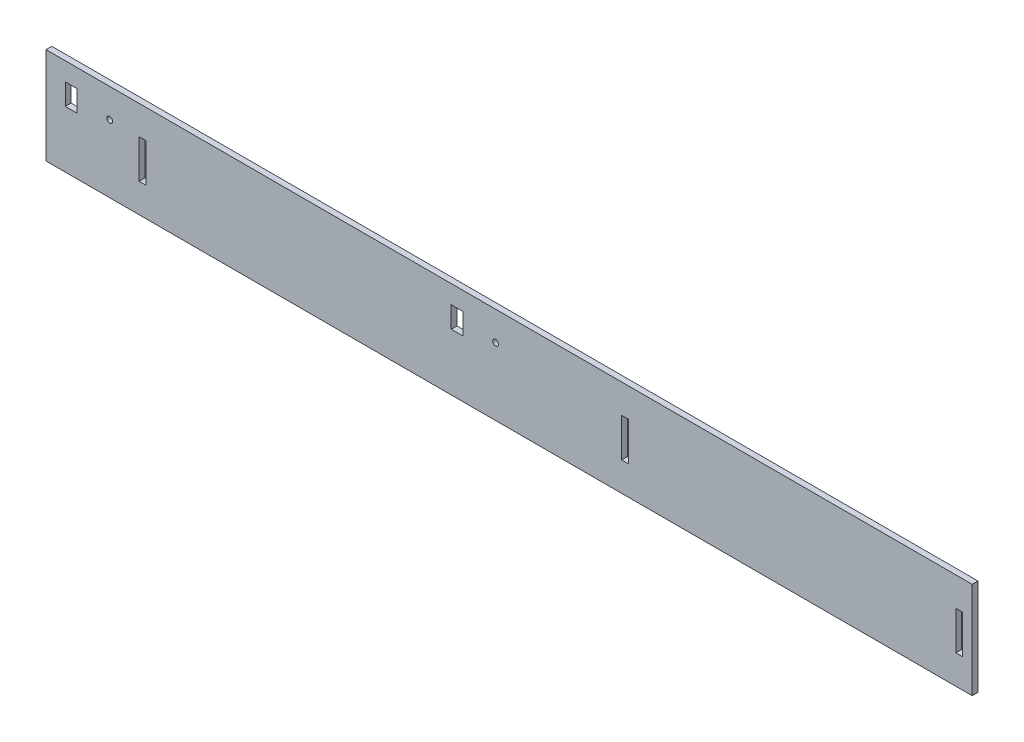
SolidWorks part; units mm, degrees
ref_plane "Plan de face" through (0, 0, 0) normal (0, 0, 1) x (1, 0, 0)
ref_plane "Plan de dessus" through (0, 0, 0) normal (0, 1, 0) x (1, 0, 0)
ref_plane "Plan de droite" through (0, 0, 0) normal (1, 0, 0) x (0, 0, -1)
sketch "Esquisse1" plane through (0, 0, 0) normal (0, 0, 1) x (1, 0, 0)
  line L0 (0, 35) -> (480, 35) construction
  line L1 (0, 50) -> (480, 50)
  line L2 (0, 50) -> (0, 0)
  line L3 (0, 0) -> (480, 0)
  line L4 (480, 50) -> (480, 0)
  line L5 (210, 40.5) -> (216, 40.5)
  line L6 (10, 40.5) -> (16, 40.5)
  line L7 (10, 40.5) -> (10, 29.5)
  line L8 (10, 29.5) -> (16, 29.5)
  line L9 (16, 40.5) -> (16, 29.5)
  line L10 (210, 40.5) -> (210, 29.5)
  line L11 (210, 29.5) -> (216, 29.5)
  line L12 (216, 40.5) -> (216, 29.5)
  line L14 (48.25, 35) -> (51.75, 35)
  line L15 (48.25, 35) -> (48.25, 15)
  line L16 (48.25, 15) -> (51.75, 15)
  line L17 (51.75, 35) -> (51.75, 15)
  line L18 (298.25, 35) -> (301.75, 35)
  line L19 (298.25, 35) -> (298.25, 15)
  line L20 (298.25, 15) -> (301.75, 15)
  line L21 (301.75, 35) -> (301.75, 15)
  line L22 (471.5, 35) -> (475, 35)
  line L23 (471.5, 35) -> (471.5, 15)
  line L24 (471.5, 15) -> (475, 15)
  line L25 (475, 35) -> (475, 15)
  circle A0 centre (33, 35) radius 1.5
  circle A1 centre (233, 35) radius 1.5
  point P13 (13, 29.5)
  point P24 (50, 15)
  point P29 (48.25, 25)
  dimension "D8" = 3
  dimension "D11" = 3.5
  dimension "D1" = 50
  dimension "D2" = 480
  dimension "D3" = 35
  dimension "D4" = 6
  dimension "D5" = 11
  dimension "D6" = 5.5
  dimension "D7" = 10
  dimension "D9" = 20
  dimension "D12" = 15
  dimension "D13" = 15
  dimension "D14" = 50
  dimension "D15" = 15
  dimension "D16" = 15
  dimension "D17" = 3.5
  dimension "D18" = 250
  dimension "D19" = 15
  dimension "D20" = 3.5
  dimension "D21" = 5
  dimension "D10" = 2
extrude "Boss.-Extru.1" add sketch "Esquisse1" along normal blind 3
